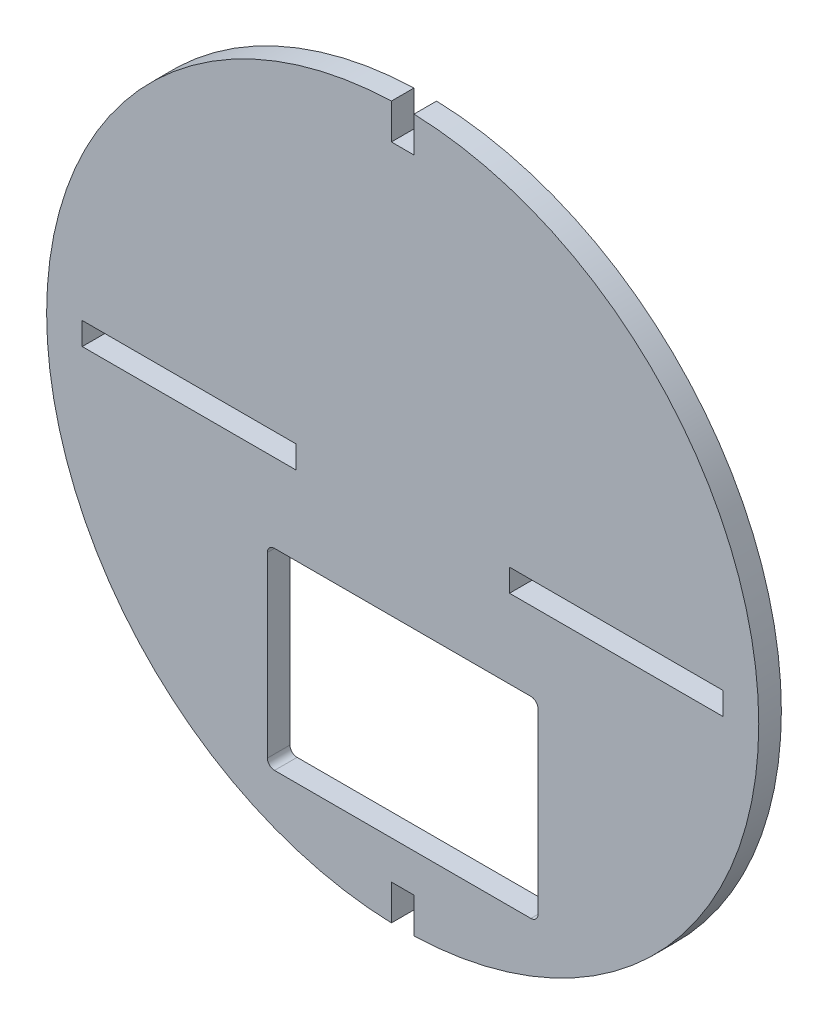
SolidWorks part; units mm, degrees
ref_plane "Front Plane" through (0, 0, 0) normal (0, 0, 1) x (1, 0, 0)
ref_plane "Top Plane" through (0, 0, 0) normal (0, 1, 0) x (1, 0, 0)
ref_plane "Right Plane" through (0, 0, 0) normal (1, 0, 0) x (0, 0, -1)
sketch "Sketch2" plane through (0, 0, 0) normal (0, 0, 1) x (1, 0, 0)
  line L0 (50, 0) -> (-50, 0) construction
  line L1 (0, -50) -> (0, 50) construction
  line L2 (-45, -1.5875) -> (-15, -1.5875)
  line L3 (-45, -1.5875) -> (-45, 1.5875)
  line L4 (-45, 1.5875) -> (-15, 1.5875)
  line L5 (-15, -1.5875) -> (-15, 1.5875)
  line L6 (-45, -1.5875) -> (-15, 1.5875) construction
  line L7 (-45, 1.5875) -> (-15, -1.5875) construction
  line L8 (45, 1.5875) -> (15, -1.5875) construction
  line L9 (45, -1.5875) -> (15, 1.5875) construction
  line L10 (15, -1.5875) -> (15, 1.5875)
  line L11 (45, 1.5875) -> (15, 1.5875)
  line L12 (45, -1.5875) -> (45, 1.5875)
  line L13 (45, -1.5875) -> (15, -1.5875)
  line L15 (-18, -12.6301) -> (18, -12.6301)
  line L16 (-19, -13.6301) -> (-19, -38.6301)
  line L17 (-18, -39.6301) -> (18, -39.6301)
  line L18 (19, -13.6301) -> (19, -38.6301)
  line L20 (38.1, 22.3622) -> (-38.1, -23.3578) construction
  line L21 (38.1, -23.3578) -> (-38.1, 22.3622) construction
  line L22 (-1.5875, -49.9748) -> (-1.5875, -45)
  line L23 (-1.5875, -45) -> (1.5875, -45)
  line L24 (1.5875, -49.9748) -> (1.5875, -45)
  line L25 (-1.5875, 49.9748) -> (-1.5875, 45)
  line L26 (-1.5875, 45) -> (1.5875, 45)
  line L27 (1.5875, 49.9748) -> (1.5875, 45)
  arc A0 (1.5875, -49.9748) -> (1.5875, 49.9748) centre (0, 0) ccw
  arc A1 (-19, -13.6301) -> (-18, -12.6301) centre (-18, -13.6301) cw
  arc A2 (19, -38.6301) -> (18, -39.6301) centre (18, -38.6301) cw
  arc A3 (-18, -39.6301) -> (-19, -38.6301) centre (-18, -38.6301) cw
  arc A4 (19, -13.6301) -> (18, -12.6301) centre (18, -13.6301) ccw
  arc A5 (-1.5875, 49.9748) -> (-1.5875, -49.9748) centre (0, 0) ccw
  point P3 (-30, 0)
  point P6 (0, 0)
  point P14 (0, 0)
  point P18 (30, 0)
  point P23 (0, -12.6301)
  point P28 (0, -0.4978)
  point P33 (19, -39.6301)
  point P36 (-19, -39.6301)
  point P39 (19, -12.6301)
  point P44 (0, -45)
  point P48 (0, 45)
  dimension "D1" = 100
  dimension "D5" = 38
  dimension "D6" = 27
  dimension "D7" = 1
  dimension "D8" = 1
  dimension "D9" = 45.72
  dimension "D2" = 30
  dimension "D3" = 3.175
  dimension "D4" = 15
  dimension "D10" = 3.175
  dimension "D11" = 5
  dimension "D12" = 5
  dimension "D13" = 3.175
extrude "Boss-Extrude1" add sketch "Sketch2" along normal blind 3.175
